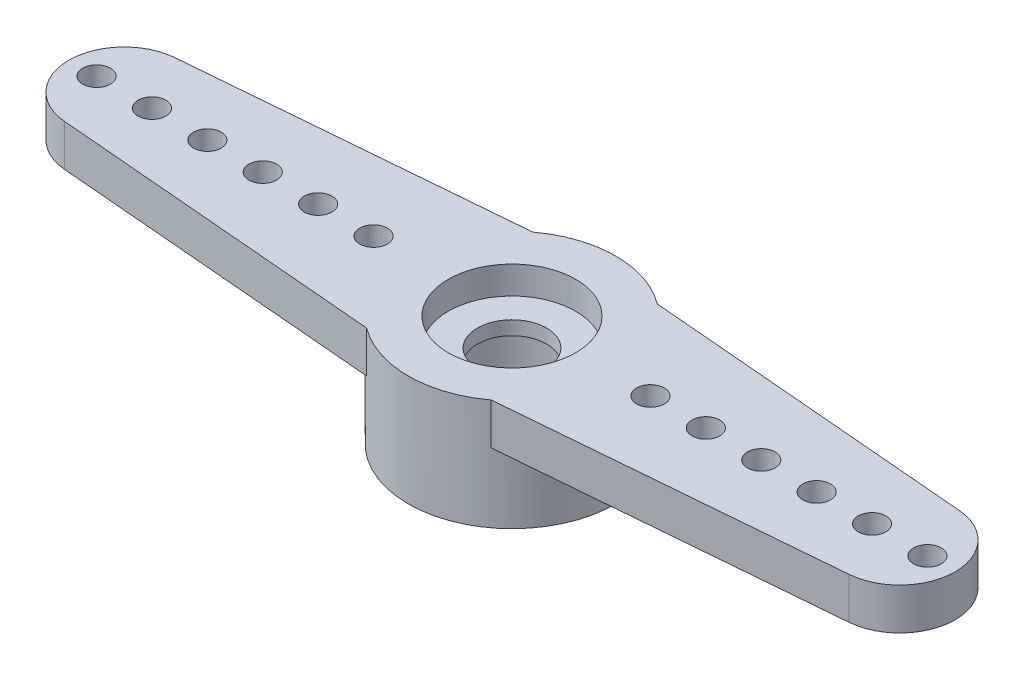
SolidWorks part; units mm, degrees
ref_plane "Front Plane" through (0, 0, 0) normal (0, 0, 1) x (1, 0, 0)
ref_plane "Top Plane" through (0, 0, 0) normal (0, 1, 0) x (1, 0, 0)
ref_plane "Right Plane" through (0, 0, 0) normal (1, 0, 0) x (0, 0, -1)
sketch "Sketch1" plane through (0, 0, 0) normal (0, 1, 0) x (1, 0, 0)
  circle A0 centre (0, 0) radius 3.75
  dimension "D1" = 7.5
extrude "Boss-Extrude1" add sketch "Sketch1" along normal blind 4
sketch "Sketch2" plane through (0, 4, 0) normal (0, 1, 0) x (1, 0, 0)
  circle A0 centre (0, 0) radius 2.3
  dimension "D1" = 4.6
extrude "Cut-Extrude1" cut sketch "Sketch2" against normal blind 1
sketch "Sketch3" plane through (0, 4, 0) normal (0, 1, 0) x (1, 0, 0)
  line L0 (16, 0) -> (-16, 0) construction
  line L1 (-14.1684, 1.9929) -> (-2.25, 3)
  line L2 (-14.1684, -1.9929) -> (-2.25, -3)
  line L3 (0, -3.75) -> (0, 3.75) construction
  line L4 (14.1684, -1.9929) -> (2.25, -3)
  line L5 (14.1684, 1.9929) -> (2.25, 3)
  arc A0 (-14.1684, 1.9929) -> (-14.1684, -1.9929) centre (-14, 0) ccw
  circle A1 centre (0, 0) radius 3.75 construction
  arc A2 (-2.25, 3) -> (-2.25, -3) centre (0, 0) ccw
  arc A3 (2.25, 3) -> (2.25, -3) centre (0, 0) cw
  arc A4 (14.1684, 1.9929) -> (14.1684, -1.9929) centre (14, 0) cw
  circle A5 centre (-15, 0) radius 0.5
  circle A6 centre (-13, 0) radius 0.5
  circle A7 centre (-11, 0) radius 0.5
  circle A8 centre (-9, 0) radius 0.5
  circle A9 centre (-7, 0) radius 0.5
  circle A10 centre (-5, 0) radius 0.5
  circle A11 centre (15, 0) radius 0.5
  circle A12 centre (5, 0) radius 0.5
  circle A13 centre (7, 0) radius 0.5
  circle A14 centre (9, 0) radius 0.5
  circle A15 centre (11, 0) radius 0.5
  circle A16 centre (13, 0) radius 0.5
  point P4 (0, 0)
  dimension "D2" = 4
  dimension "D4" = 1
  dimension "D5" = 6
  dimension "D1" = 16
  dimension "D3" = 3
  dimension "D6" = 1
extrude "Boss-Extrude2" add sketch "Sketch3" against normal blind 1.5
sketch "Sketch4" plane through (0, 3, 0) normal (0, 1, 0) x (1, 0, 0)
  circle A0 centre (0, 0) radius 1.25
  dimension "D1" = 2.5
extrude "Cut-Extrude2" cut sketch "Sketch4" against normal blind 4.5
sketch "Sketch5" plane through (0, 0, 0) normal (0, -1, 0) x (1, 0, 0)
  circle A0 centre (0, 0) radius 2.3
  dimension "D1" = 4.6
extrude "Cut-Extrude3" cut sketch "Sketch5" against normal blind 2.5
